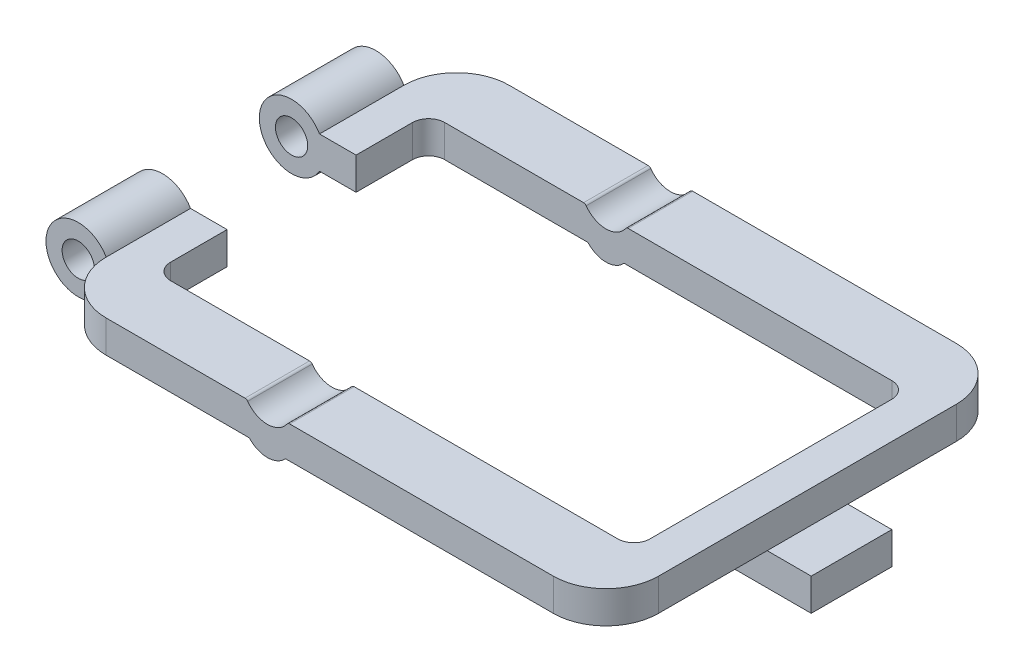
SolidWorks part; units mm, degrees
ref_plane "Face" through (0, 0, 0) normal (0, 0, 1) x (1, 0, 0)
ref_plane "Dessus" through (0, 0, 0) normal (0, 1, 0) x (1, 0, 0)
ref_plane "Droite" through (0, 0, 0) normal (1, 0, 0) x (0, 0, -1)
sketch "Esquisse1" plane through (0, 0, 0) normal (0, 0, 1) x (1, 0, 0)
  line L0 (360, -10) -> (17.3205, -10)
  line L4 (360, 10) -> (17.3205, 10)
  line L5 (0, 0) -> (107.2667, 0) construction
  line L8 (360, 10) -> (360, -10)
  arc A0 (17.3205, 10) -> (17.3205, -10) centre (0, 0) ccw
  dimension "D1" = 20
  dimension "D7" = 20
extrude "Extrusion1" add sketch "Esquisse1" along normal mid plane 250
sketch "Esquisse6" plane through (0, 0, 125) normal (0, 0, 1) x (1, 0, 0)
  line L0 (138.8197, -10) -> (161.1803, -10)
  line L1 (17.3205, -10) -> (360, -10) construction
  arc A0 (138.8197, -10) -> (161.1803, -10) centre (150, 0) ccw
  dimension "D1" = 15
  dimension "D2" = 150
extrude "Extrusion2" add sketch "Esquisse6" against normal up to surface (250 mm away)
sketch "Esquisse2" plane through (0, 10, 0) normal (0, 1, 0) x (1, 0, 0)
  line L0 (0, 0) -> (456.2074, 0) construction
  line L1 (50, 85) -> (327.32, 85)
  line L2 (40, 75) -> (40, -75)
  line L3 (50, -85) -> (327.32, -85)
  line L4 (337.32, 75) -> (337.32, -75)
  arc A0 (327.32, 85) -> (337.32, 75) centre (327.32, 75) cw
  arc A1 (40, 75) -> (50, 85) centre (50, 75) cw
  arc A2 (50, -85) -> (40, -75) centre (50, -75) cw
  arc A3 (337.32, -75) -> (327.32, -85) centre (327.32, -75) cw
  point P9 (337.32, 85)
  point P12 (40, 85)
  dimension "D4" = 10
  dimension "D1" = 170
  dimension "D2" = 40
  dimension "D3" = 297.32
extrude "Enlèv. mat.-Extru.1" cut sketch "Esquisse2" against normal through all
sketch "Esquisse3" plane through (0, 0, 125) normal (0, 0, 1) x (1, 0, 0)
  circle A0 centre (0, 0) radius 10
  dimension "D1" = 20
extrude "Enlèv. mat.-Extru.2" cut sketch "Esquisse3" against normal through all
sketch "Esquisse4" plane through (0, 0, 0) normal (0, 1, 0) x (1, 0, 0)
  line L0 (-20, 125) -> (-20, -125) construction
  line L1 (-20, 40) -> (40, 40)
  line L2 (-20, 40) -> (-20, -40)
  line L3 (-20, -40) -> (40, -40)
  line L4 (40, 40) -> (40, -40)
  line L5 (40, 75) -> (40, -75) construction
  line L6 (0, 0) -> (182.0172, 0) construction
  dimension "D1" = 80
extrude "Enlèv. mat.-Extru.3" cut sketch "Esquisse4" along normal through all and the other way through all
sketch "Esquisse10" plane through (0, 10, 0) normal (0, 1, 0) x (1, 0, 0)
  line L0 (17.3205, 40) -> (17.3205, 125) construction
  line L1 (360, 125) -> (17.3205, 125) construction
  line L2 (17.3205, 92.3205) -> (-20, 92.3205)
  line L3 (-20, 125) -> (-20, 40) construction
  line L4 (-20, 92.3205) -> (-20, 125)
  line L5 (-20, 125) -> (50, 125)
  line L6 (0, 0) -> (281.0479, 0) construction
  line L7 (-20, -125) -> (50, -125)
  line L8 (-20, -92.3205) -> (-20, -125)
  line L9 (17.3205, -92.3205) -> (-20, -92.3205)
  line L10 (188.66, 85) -> (188.66, -153.63) construction
  line L11 (327.32, 85) -> (50, 85) construction
  line L12 (359.9995, -92.3205) -> (397.32, -92.3205)
  line L13 (397.32, -92.3205) -> (397.32, -125)
  line L14 (397.32, -125) -> (327.32, -125)
  line L15 (397.32, 125) -> (327.32, 125)
  line L16 (397.32, 92.3205) -> (397.32, 125)
  line L17 (359.9995, 92.3205) -> (397.32, 92.3205)
  arc A0 (50, 125) -> (17.3205, 92.3205) centre (50, 92.3205) ccw
  arc A2 (50, -125) -> (17.3205, -92.3205) centre (50, -92.3205) cw
  arc A3 (327.32, -125) -> (359.9995, -92.3205) centre (327.32, -92.3205) ccw
  arc A4 (327.32, 125) -> (359.9995, 92.3205) centre (327.32, 92.3205) cw
extrude "Enlèv. mat.-Extru.7" cut sketch "Esquisse10" against normal through all and the other way through all
sketch "Esquisse11" plane through (0, -10, 0) normal (0, -1, 0) x (1, 0, 0)
  line L0 (337.32, 75) -> (337.32, -75) construction
  line L1 (337.32, 25) -> (387.32, 25)
  line L2 (337.32, 25) -> (337.32, -25)
  line L3 (337.32, -25) -> (387.32, -25)
  line L4 (387.32, 25) -> (387.32, -25)
  line L5 (0, 0) -> (264.2056, 0) construction
  dimension "D1" = 50
  dimension "D2" = 50
extrude "Extrusion3" add sketch "Esquisse11" along normal blind 20
sketch "Esquisse12" plane through (0, 0, 125) normal (0, 0, 1) x (1, 0, 0)
  line L0 (137.2181, 10) -> (162.7819, 10)
  line L1 (327.32, 10) -> (50, 10) construction
  arc A0 (137.2181, 10) -> (162.7819, 10) centre (150, 17.8501) ccw
  dimension "D1" = 15
extrude "Enlèv. mat.-Extru.8" cut sketch "Esquisse12" against normal through all
fillet "Congé1" radius 2 4 edges at (162.7819, 10, -105) (137.2181, 10, -105) (137.2181, 10, 105) (162.7819, 10, 105)
fillet "Congé2" radius 2 4 edges at (138.8197, -10, -105) (161.1803, -10, -105) (161.1803, -10, 105) (138.8197, -10, 105)
